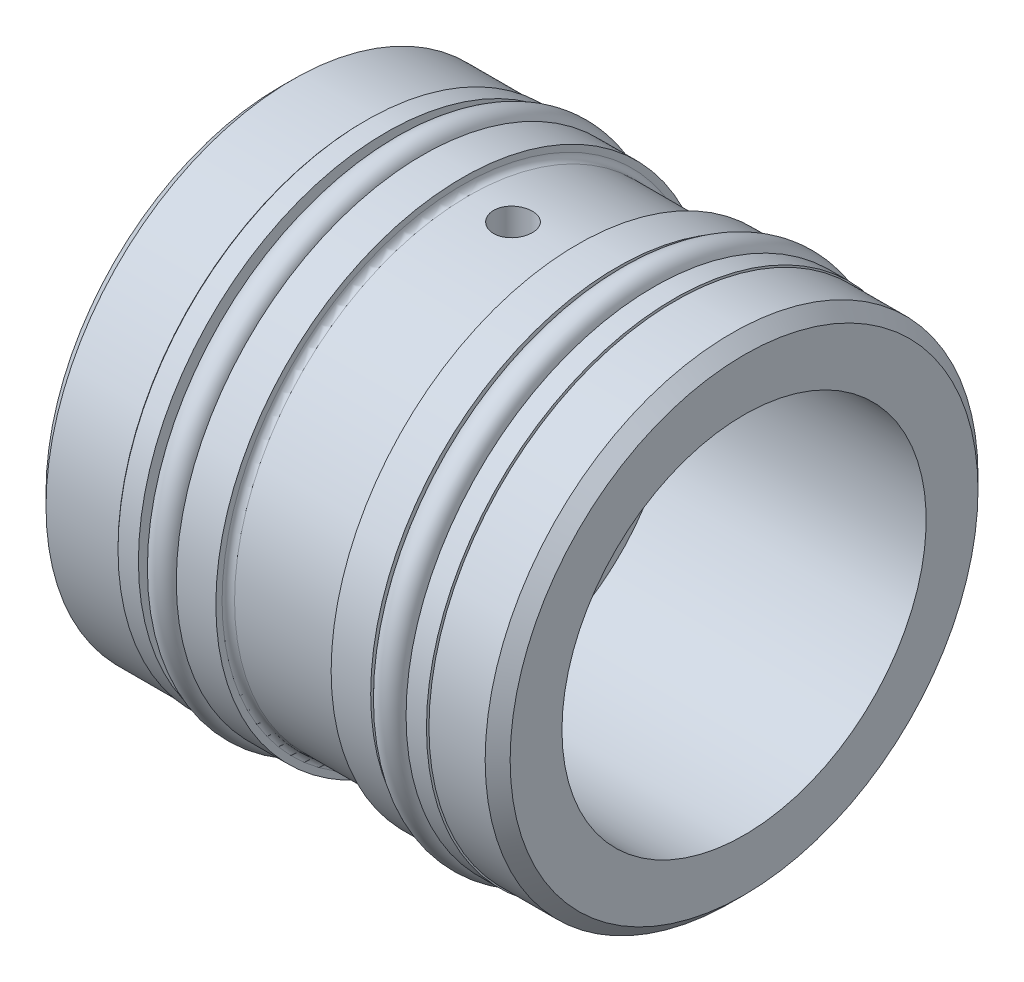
SolidWorks part; units mm, degrees
ref_plane "Front Plane" through (0, 0, 0) normal (0, 0, 1) x (1, 0, 0)
ref_plane "Top Plane" through (0, 0, 0) normal (0, 1, 0) x (1, 0, 0)
ref_plane "Right Plane" through (0, 0, 0) normal (1, 0, 0) x (0, 0, -1)
sketch "Sketch1" plane through (0, 0, 0) normal (0, 0, 1) x (1, 0, 0)
  line L0 (0, 0) -> (0, 45.5562) construction
  line L1 (0, 0) -> (32.8567, 0) construction
  line L2 (-14.1605, 6.35) -> (-14.1605, 15.0368)
  line L3 (-14.1605, 15.0368) -> (-9.0043, 15.0368)
  line L4 (-9.0043, 15.0368) -> (-9.0043, 13.7668)
  line L5 (-9.0043, 13.7668) -> (-5.4483, 13.7668)
  line L6 (-5.4483, 13.7668) -> (-5.4483, 15.0368)
  line L7 (-5.4483, 15.0368) -> (-3.0353, 15.0368)
  line L8 (-3.0353, 15.0368) -> (-3.0353, 14.2748)
  line L9 (-3.0353, 14.2748) -> (4.0005, 14.2748)
  line L10 (-14.1605, 6.35) -> (-1.2319, 6.35)
  line L11 (-1.2319, 6.35) -> (-1.2319, 11.1125)
  line L12 (-1.2319, 11.1125) -> (14.1605, 11.1125)
  line L13 (4.0005, 15.0368) -> (4.0005, 14.2748)
  line L14 (6.4135, 15.0368) -> (4.0005, 15.0368)
  line L15 (6.4135, 13.7668) -> (6.4135, 15.0368)
  line L16 (9.9695, 13.7668) -> (6.4135, 13.7668)
  line L17 (9.9695, 15.0368) -> (9.9695, 13.7668)
  line L18 (14.1605, 15.0368) -> (9.9695, 15.0368)
  line L19 (14.1605, 15.0368) -> (14.1605, 11.1125)
  dimension "D2" = 3.556
  dimension "D3" = 7.0358
  dimension "D4" = 30.0736
  dimension "D5" = 28.321
  dimension "D6" = 22.225
  dimension "D7" = 15.3924
  dimension "D8" = 28.5496
  dimension "D9" = 27.5336
  dimension "D10" = 12.7
  dimension "D11" = 23.1648
  dimension "D12" = 2.413
  dimension "D13" = 2.413
revolve "Revolve1" add sketch "Sketch1" angle 360 about L1
fillet "Fillet1" radius 0.381 2 edges at (4.0005, 0, 14.2748) (-3.0353, 0, 14.2748)
chamfer "Chamfer1" distance 0.762 angle 45 2 edges at (14.1605, 0, 15.0368) (-14.1605, 0, 15.0368)
sketch "Sketch6" plane through (0, 0, 0) normal (0, 0, 1) x (1, 0, 0)
  line L0 (0, 0) -> (49.5791, 0) construction
  line L1 (-14.1605, 14.2748) -> (-14.1605, -14.2748) construction
  line L2 (-5.4483, 13.7668) -> (-9.0043, 13.7668) construction
  line L3 (-8.9281, 13.7668) -> (-7.6835, 13.7668)
  line L4 (-8.9281, 13.7668) -> (-8.9281, 15.113)
  line L5 (-8.9281, 15.113) -> (-7.6835, 15.113)
  line L6 (-7.6835, 13.7668) -> (-7.6835, 15.113)
  line L7 (0.4826, 41.4439) -> (0.4826, -9.3524) construction
  line L8 (-9.0043, -15.0368) -> (-9.0043, 15.0368) construction
  line L9 (9.9695, 13.7668) -> (9.9695, -13.7668) construction
  line L10 (-5.4483, 15.0368) -> (-5.4483, -15.0368) construction
  line L11 (8.6487, 13.7668) -> (8.6487, 15.113)
  line L12 (9.8933, 15.113) -> (8.6487, 15.113)
  line L13 (9.8933, 13.7668) -> (9.8933, 15.113)
  line L14 (9.8933, 13.7668) -> (8.6487, 13.7668)
  circle A0 centre (-6.4135, 14.5796) radius 0.889
  circle A1 centre (7.3787, 14.5796) radius 0.889
  dimension "D4" = 1.778
  dimension "D5" = 29.1592
  dimension "D6" = 0.9652
  dimension "D1" = 1.2446
  dimension "D2" = 5.2324
  dimension "D3" = 30.226
revolve "Revolve3" add sketch "Sketch6" angle 360 about L0
sketch "Sketch7" plane through (0, 0, 0) normal (0, 1, 0) x (0, 0, -1)
  line L1 (-14.2748, -14.1605) -> (14.2748, -14.1605) construction
  circle A0 centre (0, -0.0635) radius 1.1811
  dimension "D1" = 2.3622
  dimension "D2" = 14.097
extrude "Cut-Extrude1" cut sketch "Sketch7" against normal through all and the other way through all
